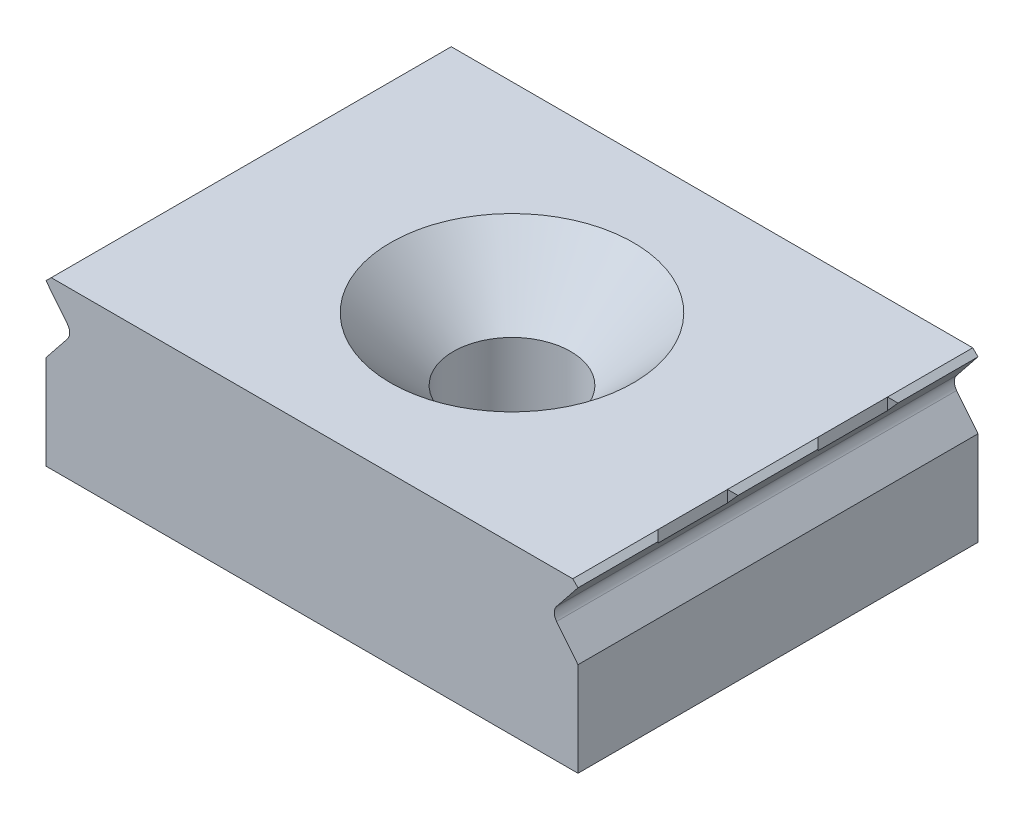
SolidWorks part; units mm, degrees
ref_plane "Front Plane" through (0, 0, 0) normal (0, 0, 1) x (1, 0, 0)
ref_plane "Top Plane" through (0, 0, 0) normal (0, 1, 0) x (1, 0, 0)
ref_plane "Right Plane" through (0, 0, 0) normal (1, 0, 0) x (0, 0, -1)
sketch "Sketch1" plane through (0, 0, 0) normal (0, 1, 0) x (1, 0, 0)
  line L1 (12.7, -9.55) -> (-12.7, -9.55)
  line L2 (12.7, -9.55) -> (12.7, 9.55)
  line L3 (12.7, 9.55) -> (-12.7, 9.55)
  line L4 (-12.7, -9.55) -> (-12.7, 9.55)
  line L5 (12.7, -9.55) -> (-12.7, 9.55) construction
  line L6 (12.7, 9.55) -> (-12.7, -9.55) construction
  point P0 (0, 0)
  dimension "D1" = 25.4
  dimension "D2" = 19.1
extrude "Boss-Extrude1" add sketch "Sketch1" along normal mid plane 7.92
chamfer "Chamfer1" distance 0.25 angle 45 2 edges at (12.7, 3.96, 0) (-12.7, 3.96, 0)
sketch "Sketch2" plane through (0, 0, 9.55) normal (0, 0, 1) x (1, 0, 0)
  line L0 (-12.7, 3.71) -> (-12.7, 0.53)
  line L1 (-12.7, 3.71) -> (-12.7, -3.96) construction
  line L2 (-12.7, 3.71) -> (-11.6792, 2.432)
  line L3 (-11.6792, 1.808) -> (-12.7, 0.53)
  arc A0 (-11.6792, 2.432) -> (-11.6792, 1.808) centre (-12.0699, 2.12) cw
  point P8 (-11.43, 2.12)
  dimension "D4" = 0.5
  dimension "D1" = 3.18
  dimension "D2" = 1.59
  dimension "D3" = 1.27
extrude "Cut-Extrude1" cut sketch "Sketch2" against normal up to surface (19.1 mm away)
mirror "Mirror1" about plane through (0, 0, 0) normal (1, 0, 0) of "Cut-Extrude1"
sketch "Sketch3" plane through (0, 3.96, 0) normal (0, 1, 0) x (1, 0, 0)
  line L0 (-12.7, -5.73) -> (-12.7, -1.91)
  line L1 (-12.7, -9.55) -> (-12.7, 9.55) construction
  line L2 (-12.7, -1.91) -> (-12.45, -2.16)
  line L3 (-12.45, 9.55) -> (-12.45, -9.55) construction
  line L4 (-12.45, -2.16) -> (-12.45, -5.48)
  line L5 (-12.45, -5.48) -> (-12.7, -5.73)
  line L6 (-12.45, -9.55) -> (-12.7, -9.55) construction
  line L7 (12.7, -5.73) -> (12.45, -5.48)
  line L8 (12.7, 9.55) -> (12.7, -9.55) construction
  line L9 (12.45, -9.55) -> (12.45, 9.55) construction
  line L10 (12.45, -5.48) -> (12.45, -2.16)
  line L11 (12.45, -2.16) -> (12.7, -1.91)
  line L12 (12.7, -1.91) -> (12.7, -5.73)
  line L13 (-12.45, -9.55) -> (12.45, -9.55) construction
  dimension "D1" = 3.82
  dimension "D2" = 90
  dimension "D3" = 3.82
  dimension "D4" = 3.82
extrude "Cut-Extrude2" cut sketch "Sketch3" against normal blind 1
pattern_linear "LPattern1" count 2 spacing 7.64 along (0, 0, -1) of "Cut-Extrude2"
sketch "Sketch4" plane through (0, 3.96, 0) normal (0, 1, 0) x (1, 0, 0)
  circle A0 centre (0, 0) radius 2.8
  dimension "D1" = 5.6
extrude "Cut-Extrude3" cut sketch "Sketch4" against normal up to surface (7.92 mm away)
chamfer "Chamfer2" distance 3 angle 45 1 edges at (0, 3.96, 2.8)
